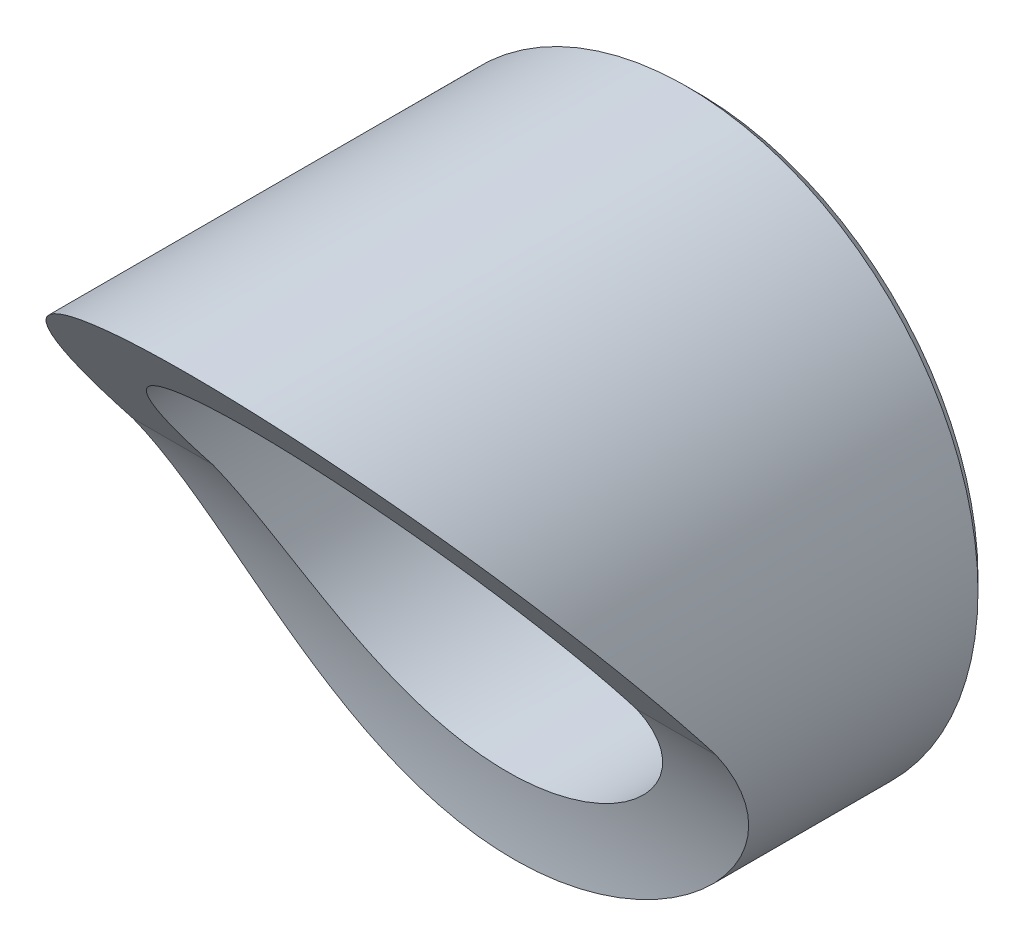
SolidWorks part; units mm, degrees
ref_plane "前视基准面" through (0, 0, 0) normal (0, 0, 1) x (1, 0, 0)
ref_plane "上视基准面" through (0, 0, 0) normal (0, 1, 0) x (1, 0, 0)
ref_plane "右视基准面" through (0, 0, 0) normal (1, 0, 0) x (0, 0, -1)
other "Configuration Table"
sketch "草图1" plane through (0, 0, 0) normal (0, 0, 1) x (1, 0, 0)
  circle A0 centre (0, 0) radius 12
  dimension "D1" = 24
extrude "凸台-拉伸1" add sketch "草图1" along normal blind 21
sketch "草图2" plane through (0, 0, 0) normal (1, 0, 0) x (0, 0, -1)
  line L0 (-21, 12) -> (-11.2645, -0.4609)
  line L1 (-21, 12) -> (-30.1102, -10.4763)
  line L2 (-21, -12) -> (0, -12) construction
  line L3 (0, -12) -> (0, 12) construction
  line L4 (0, 12) -> (-21, 12) construction
  line L5 (0, -12) -> (-21, -12) construction
  line L6 (-21, 12) -> (-21, -12) construction
  line L7 (-30.1102, -10.4763) -> (-18.1489, -15.6202)
  line L8 (-18.1489, -15.6202) -> (-7.6, -12)
  arc A0 (-11.2645, -0.4609) -> (-7.6, -12) centre (-27.6, -12) cw
  dimension "D3" = 20
  dimension "D1" = 7.6
  dimension "D2" = 52
extrude "切除-拉伸1" cut sketch "草图2" against normal mid plane 100
chamfer "倒角1" distance 0.5 1 edges at (12, 0, 0)
sketch "草图5" plane through (0, 0, 0) normal (0, 0, -1) x (-1, 0, 0)
  point P0 (0, 0)
hole_wizard "M20 螺纹孔1" positions "草图5" profile "草图4" tap size "M20" standard "GB"
sketch "草图4" plane through (0, 0, 0) normal (1, 0, 0) x (0, 1, 0)
  line L0 (0, 0) -> (0, 21)
  line L1 (0, 21) -> (8.75, 21)
  line L2 (8.75, 21) -> (8.75, 1.275)
  line L3 (8.75, 1.275) -> (10.025, 0)
  line L5 (10.025, 0) -> (0, 0)
  line L6 (-8.75, 1.275) -> (-10.025, 0) construction
  line L11 (0, -6.35) -> (0, 107.95) construction
  dimension "通孔螺纹孔钻头直径" = 17.5
  dimension "通孔螺纹孔钻头深度" = 21
  dimension "近端锥形沉头孔直径" = 20.05
  dimension "近端锥形沉头孔角度" = 90
